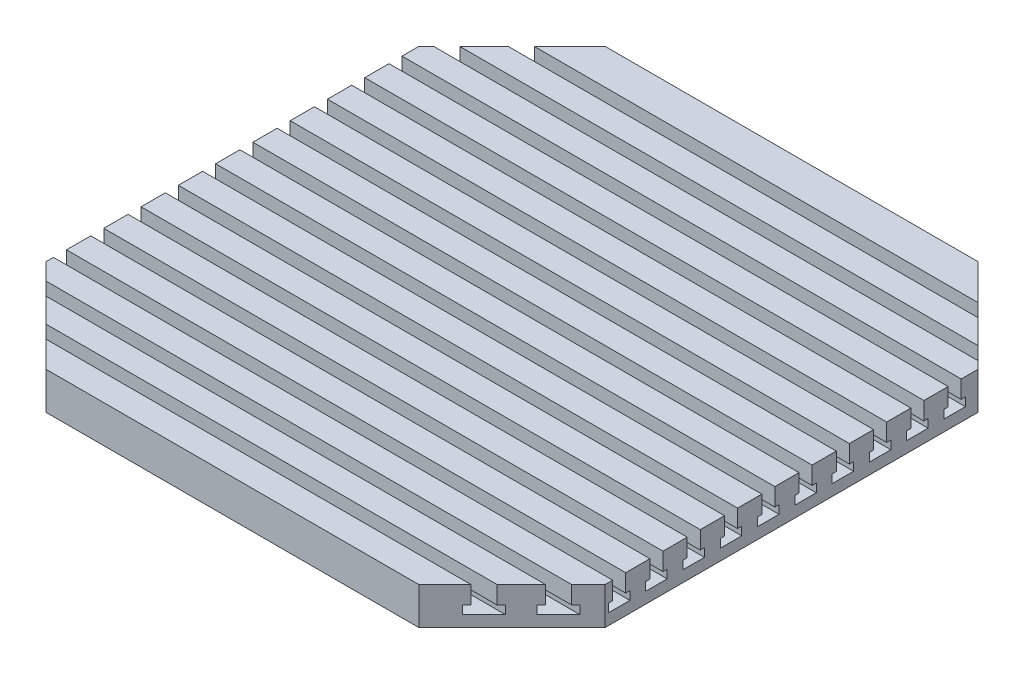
SolidWorks part; units mm, degrees
ref_plane "Face" through (0, 0, 0) normal (0, 0, 1) x (1, 0, 0)
ref_plane "Dessus" through (0, 0, 0) normal (0, 1, 0) x (1, 0, 0)
ref_plane "Droite" through (0, 0, 0) normal (1, 0, 0) x (0, 0, -1)
sketch "Esquisse1" plane through (0, 0, 0) normal (0, 1, 0) x (1, 0, 0)
  line L1 (-220, -300) -> (380, -300)
  line L2 (-220, -300) -> (-220, 300)
  line L3 (-220, 300) -> (380, 300)
  line L4 (380, -300) -> (380, 300)
  dimension "D1" = 600
  dimension "D2" = 600
  dimension "D3" = 300
  dimension "D4" = 220
extrude "Extrusion1" add sketch "Esquisse1" along normal blind 40
sketch "Esquisse2" plane through (380, 0, 0) normal (1, 0, 0) x (0, 0, -1)
  line L0 (-272, 40) -> (-272, 21)
  line L2 (-300, 40) -> (300, 40) construction
  line L3 (-272, 21) -> (-276.5, 21)
  line L4 (-276.5, 21) -> (-276.5, 12)
  line L5 (-276.5, 12) -> (-253.5, 12)
  line L6 (-253.5, 12) -> (-253.5, 21)
  line L7 (-253.5, 21) -> (-258, 21)
  line L8 (-258, 21) -> (-258, 40)
  line L9 (-258, 40) -> (-272, 40)
  line L10 (-265, 51.2922) -> (-265, -11.997) construction
  line L12 (-300, 40) -> (-300, 0) construction
  dimension "D1" = 14
  dimension "D2" = 23
  dimension "D3" = 9
  dimension "D4" = 19
  dimension "D5" = 23.5
extrude "Enlèv. mat.-Extru.1" cut sketch "Esquisse2" against normal through all
pattern_linear "Répétition linéaire2" count 14 spacing 40 along (0, 0, -1) of "Enlèv. mat.-Extru.1"
chamfer "Chanfrein1" distance 100 angle 45 4 edges at (380, 20, -300) (-220, 20, -300) (380, 20, 300) (-220, 20, 300)
